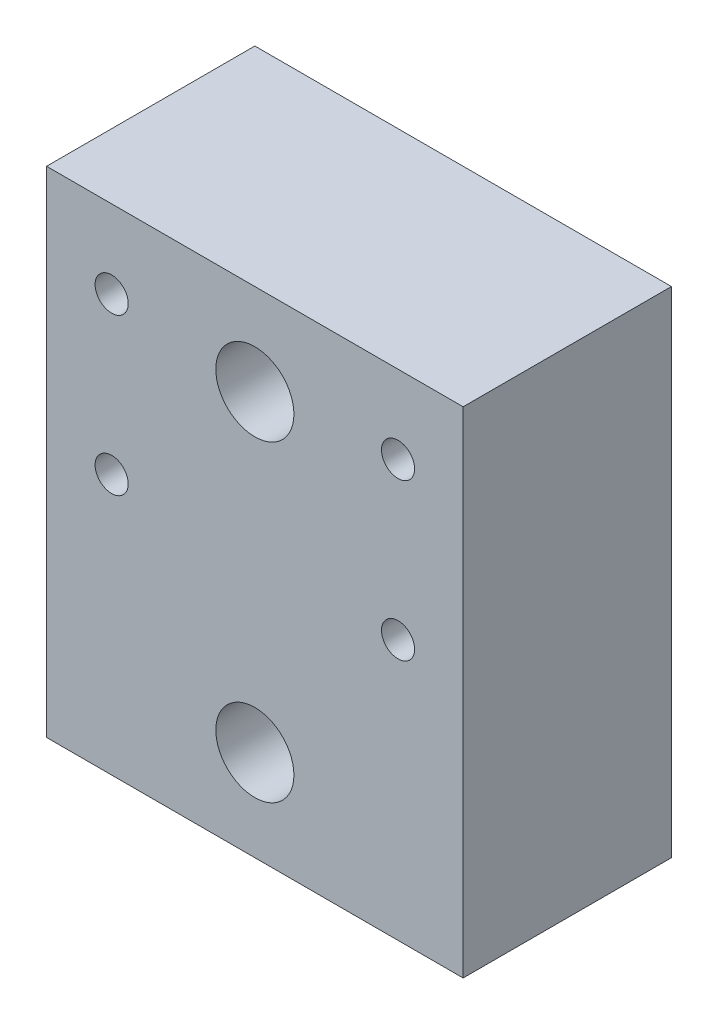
SolidWorks part; units mm, degrees
ref_plane "Front Plane" through (0, 0, 0) normal (0, 0, 1) x (1, 0, 0)
ref_plane "Top Plane" through (0, 0, 0) normal (0, 1, 0) x (1, 0, 0)
ref_plane "Right Plane" through (0, 0, 0) normal (1, 0, 0) x (0, 0, -1)
sketch "Sketch1" plane through (0, 0, 0) normal (0, 0, 1) x (1, 0, 0)
  line L1 (-25.4, 30.1625) -> (25.4, 30.1625)
  line L2 (-25.4, 30.1625) -> (-25.4, -30.1625)
  line L3 (-25.4, -30.1625) -> (25.4, -30.1625)
  line L4 (25.4, 30.1625) -> (25.4, -30.1625)
  line L5 (-25.4, 30.1625) -> (25.4, -30.1625) construction
  line L6 (-25.4, -30.1625) -> (25.4, 30.1625) construction
  point P0 (0, 0)
  dimension "D1" = 50.8
  dimension "D2" = 60.325
extrude "Boss-Extrude1" add sketch "Sketch1" along normal mid plane 25.4
hole_wizard "CBORE for #10 Socket Head Cap Screw1" positions "Sketch4" profile "Sketch3" counterbore size "#10" standard "ANSI Inch"
sketch "Sketch4" plane through (0, 0, 12.7) normal (0, 0, 1) x (1, 0, 0)
  line L0 (0, 19.05) -> (0, -19.05) construction
  point P0 (0, 19.05)
  point P1 (0, -19.05)
  dimension "D1" = 38.1
sketch "Sketch3" plane through (0, 19.05, 12.7) normal (1, 0, 0) x (0, -1, 0)
  line L0 (0, 0) -> (0, 25.4)
  line L1 (0, 25.4) -> (2.8067, 25.4)
  line L3 (2.8067, 25.4) -> (2.8067, 15.113)
  line L4 (2.8067, 15.113) -> (4.7625, 15.113)
  line L5 (4.7625, 15.113) -> (4.7625, 0)
  line L7 (4.7625, 0) -> (0, 0)
  line L11 (0, -6.35) -> (0, 107.95) construction
  dimension "Thru Hole Dia." = 5.6134
  dimension "Thru Hole Depth" = 25.4
  dimension "C'Bore Dia." = 9.525
  dimension "C'Bore Depth" = 15.113
hole_wizard "#10-32 Tapped Hole1" positions "Sketch6" profile "Sketch5" tap size "#10-32" standard "ANSI Inch"
sketch "Sketch6" plane through (0, 0, 12.7) normal (0, 0, 1) x (1, 0, 0)
  line L0 (-17.4625, 20.6375) -> (-17.4625, 1.5875) construction
  line L1 (-17.4625, 1.5875) -> (17.4625, 1.5875) construction
  line L2 (17.4625, 1.5875) -> (17.4625, 20.6375) construction
  line L3 (17.4625, 20.6375) -> (-17.4625, 20.6375) construction
  line L4 (-17.4625, 20.6375) -> (17.4625, 1.5875) construction
  line L9 (0, 20.6375) -> (0, 30.1625) construction
  line L10 (25.4, 30.1625) -> (-25.4, 30.1625) construction
  line L12 (-25.4, -30.1625) -> (25.4, -30.1625) construction
  point P0 (-17.4625, 20.6375)
  point P1 (17.4625, 20.6375)
  point P3 (17.4625, 1.5875)
  point P5 (-17.4625, 1.5875)
  dimension "D1" = 34.925
  dimension "D2" = 19.05
  dimension "D3" = 31.75
sketch "Sketch5" plane through (-17.4625, 20.6375, 12.7) normal (1, 0, 0) x (0, -1, 0)
  line L0 (0, 0) -> (0, 25.4)
  line L1 (0, 25.4) -> (2.0193, 25.4)
  line L2 (2.0193, 25.4) -> (2.0193, 0)
  line L5 (2.0193, 0) -> (0, 0)
  line L11 (0, -6.35) -> (0, 107.95) construction
  dimension "Thru Tap Drill Dia." = 4.0386
  dimension "Thru Tap Drill Depth" = 25.4
